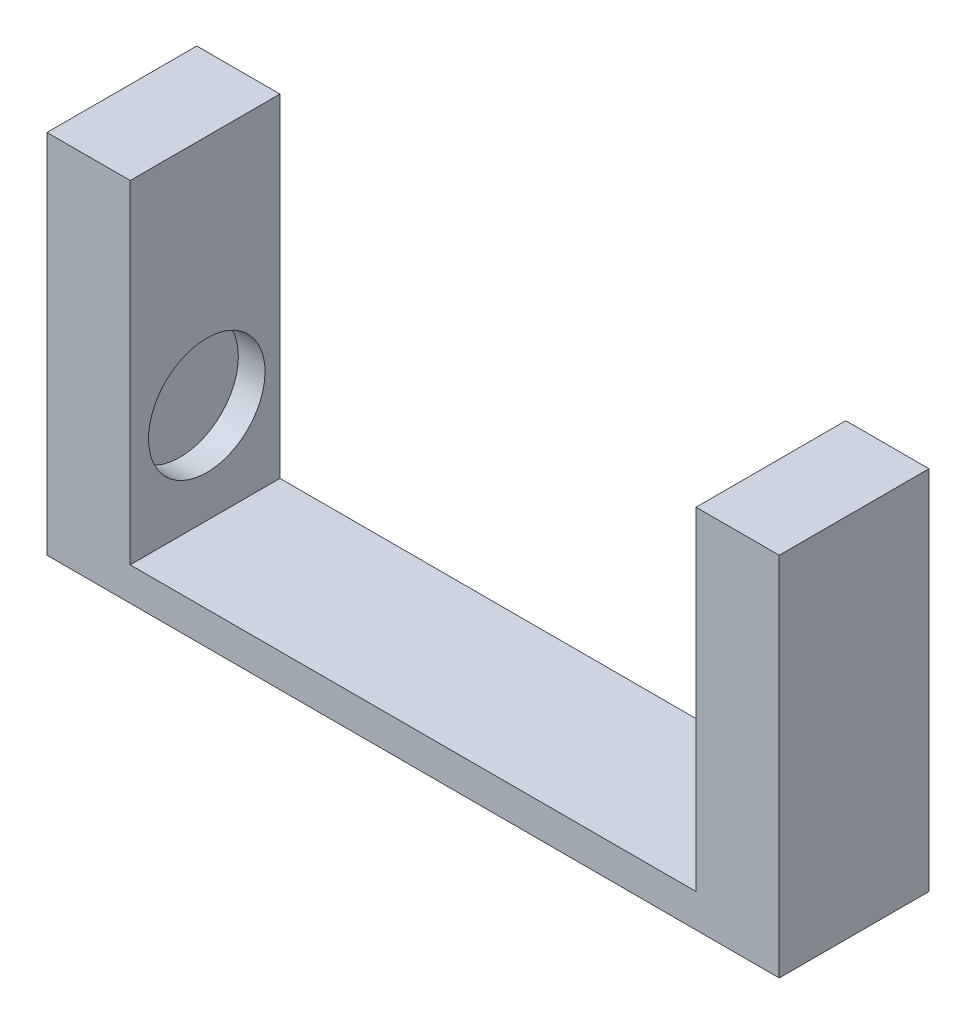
SolidWorks part; units mm, degrees
ref_plane "Plan de face" through (0, 0, 0) normal (0, 0, 1) x (1, 0, 0)
ref_plane "Plan de dessus" through (0, 0, 0) normal (0, 1, 0) x (1, 0, 0)
ref_plane "Plan de droite" through (0, 0, 0) normal (1, 0, 0) x (0, 0, -1)
sketch "Esquisse1" plane through (0, 0, 0) normal (0, 0, 1) x (1, 0, 0)
  line L1 (0, 0) -> (220, 0)
  line L2 (0, 0) -> (0, 110)
  line L3 (0, 110) -> (220, 110)
  line L4 (220, 0) -> (220, 110)
  dimension "D1" = 220
  dimension "D2" = 110
extrude "Extrusion1" add sketch "Esquisse1" along normal blind 45
sketch "Esquisse2" plane through (0, 0, 45) normal (0, 0, 1) x (1, 0, 0)
  line L0 (220, 110) -> (0, 110) construction
  line L1 (25, 110) -> (195, 110)
  line L2 (25, 110) -> (25, 10)
  line L3 (25, 10) -> (195, 10)
  line L4 (195, 110) -> (195, 10)
  line L5 (0, 110) -> (0, 0) construction
  line L6 (220, 0) -> (220, 110) construction
  line L7 (0, 0) -> (220, 0) construction
  dimension "D1" = 25
  dimension "D2" = 25
  dimension "D3" = 10
extrude "Extrusion2" cut sketch "Esquisse2" against normal blind 65
sketch "Esquisse3" plane through (195, 0, 0) normal (-1, 0, 0) x (0, 0, 1)
  line L0 (0, 10) -> (45, 10) construction
  line L1 (0, 110) -> (0, 10) construction
  circle A0 centre (23, 40) radius 17.5
  dimension "D2" = 35
  dimension "D1" = 30
  dimension "D3" = 23
extrude "Extrusion3" cut sketch "Esquisse3" against normal blind 8
sketch "Esquisse6" plane through (25, 0, 0) normal (1, 0, 0) x (0, 0, -1)
  line L0 (-45, 110) -> (-45, 10) construction
  line L1 (0, 10) -> (-45, 10) construction
  circle A0 centre (-22, 40) radius 17.5
  dimension "D2" = 35
  dimension "D1" = 23
  dimension "D3" = 30
extrude "Extrusion4" cut sketch "Esquisse6" against normal blind 8
